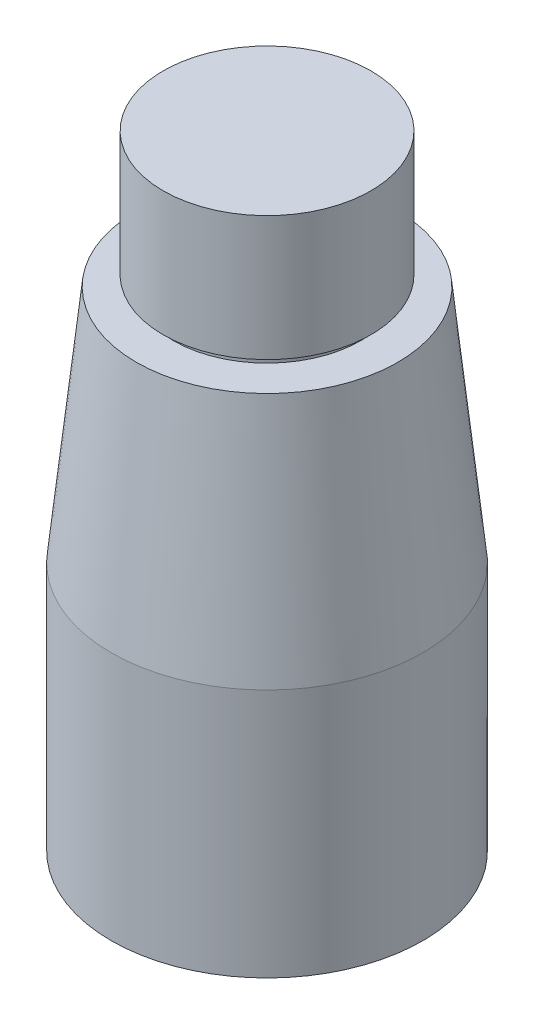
SolidWorks part; units mm, degrees
ref_plane "Front Plane" through (0, 0, 0) normal (0, 0, 1) x (1, 0, 0)
ref_plane "Top Plane" through (0, 0, 0) normal (0, 1, 0) x (1, 0, 0)
ref_plane "Right Plane" through (0, 0, 0) normal (1, 0, 0) x (0, 0, -1)
sketch "Sketch1" plane through (0, 0, 0) normal (0, 0, 1) x (1, 0, 0)
  line L0 (0, 85.1026) -> (0, 0) construction
  line L1 (0, 0) -> (-15, 0)
  line L2 (-15, 0) -> (-15, 24)
  line L3 (-15, 24) -> (-12.5826, 47)
  line L4 (-12.5826, 47) -> (-9, 47)
  line L5 (-9, 47) -> (-9, 48)
  line L6 (-9, 48) -> (-10, 48)
  line L7 (-10, 48) -> (-10, 60)
  line L8 (-10, 60) -> (0, 60)
  line L9 (0, 0) -> (0, 60)
  dimension "D1" = 60
  dimension "D2" = 1
  dimension "D3" = 23
  dimension "D4" = 6
  dimension "D5" = 12
  dimension "D6" = 15
  dimension "D7" = 10
  dimension "D8" = 1
revolve "Revolve1" add sketch "Sketch1" angle 360 about L0
